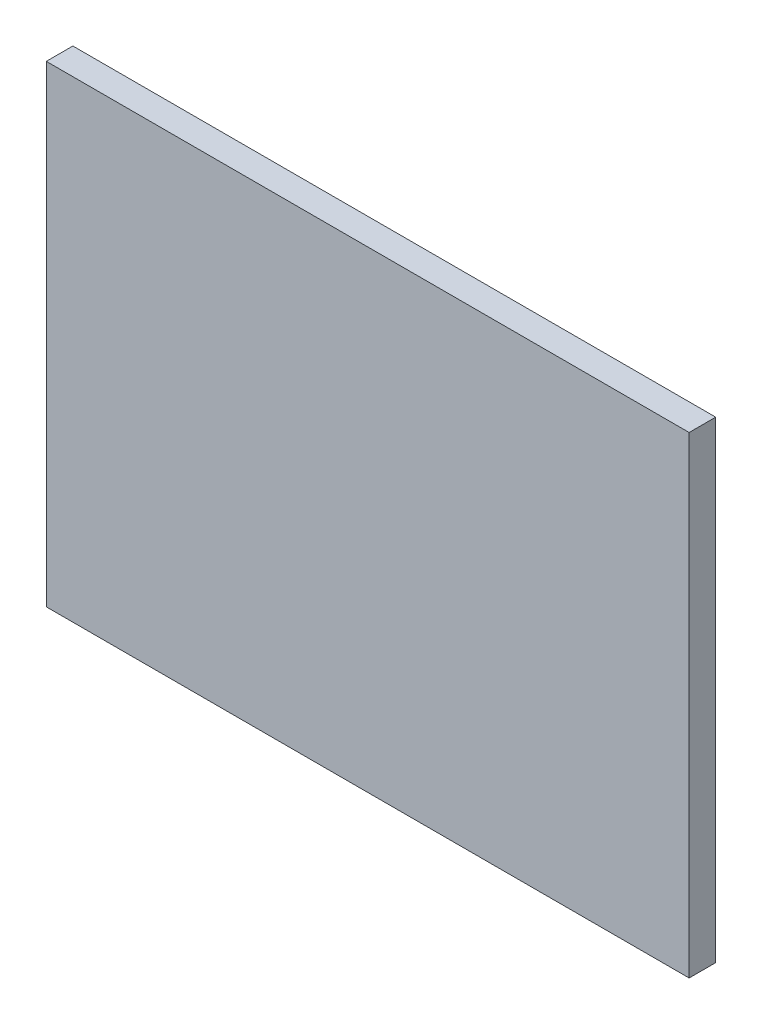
SolidWorks part; units mm, degrees
ref_plane "Front" through (0, 0, 0) normal (0, 0, 1) x (1, 0, 0)
ref_plane "Top" through (0, 0, 0) normal (0, 1, 0) x (1, 0, 0)
ref_plane "Right" through (0, 0, 0) normal (1, 0, 0) x (0, 0, -1)
sketch "Sketch1" plane through (0, 0, 0) normal (0, 0, 1) x (1, 0, 0)
  line L1 (-43.0873, 19.1972) -> (-4.9873, 19.1972)
  line L2 (-43.0873, 19.1972) -> (-43.0873, -8.8028)
  line L3 (-43.0873, -8.8028) -> (-4.9873, -8.8028)
  line L4 (-4.9873, 19.1972) -> (-4.9873, -8.8028)
  dimension "D1" = 28
  dimension "D2" = 38.1
extrude "Extrude1" add sketch "Sketch1" along normal blind 1.5748
sketch "Sketch2" plane through (0, 0, 1.5748) normal (0, 0, 1) x (1, 0, 0)
  text T0 "IMU Board" font "Century Gothic" height in points 20
